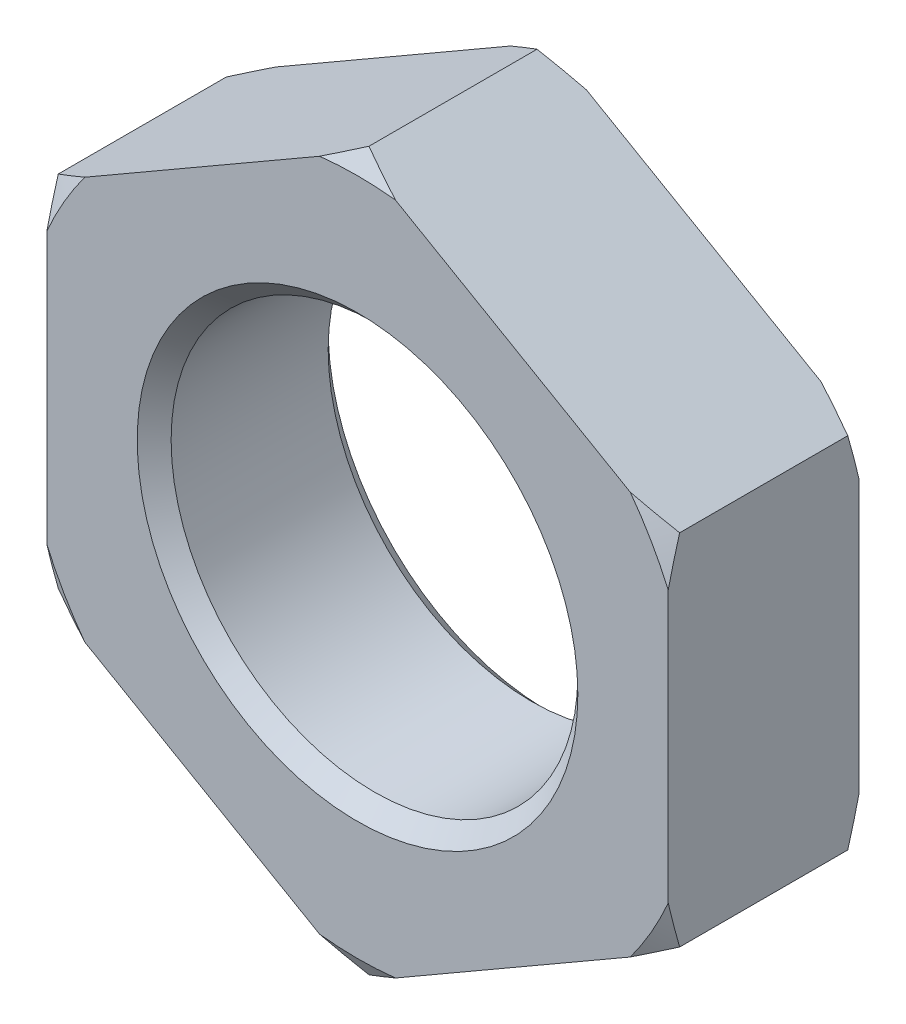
SolidWorks part; units mm, degrees
ref_plane "Front Plane" through (0, 0, 0) normal (0, 0, 1) x (1, 0, 0)
ref_plane "Top Plane" through (0, 0, 0) normal (0, 1, 0) x (1, 0, 0)
ref_plane "Right Plane" through (0, 0, 0) normal (1, 0, 0) x (0, 0, -1)
sketch "Sketch1" plane through (0, 0, 0) normal (0, 0, 1) x (1, 0, 0)
  line L1 (0, 31.7543) -> (-27.5, 15.8771)
  line L2 (-27.5, 15.8771) -> (-27.5, -15.8771)
  line L3 (-27.5, -15.8771) -> (0, -31.7543)
  line L4 (0, -31.7543) -> (27.5, -15.8771)
  line L5 (27.5, -15.8771) -> (27.5, 15.8771)
  line L6 (27.5, 15.8771) -> (0, 31.7543)
  circle A0 centre (0, 0) radius 27.5 construction
  circle A1 centre (0, 0) radius 18
  dimension "D2" = 36
  dimension "D1" = 55
extrude "Boss-Extrude1" add sketch "Sketch1" along normal mid plane 16.9
sketch "Sketch2" plane through (0, 0, 0) normal (1, 0, 0) x (0, 0, -1)
  line L0 (7.477, 0) -> (-8.5759, 0) construction
sketch "Sketch3" plane through (0, 0, 0) normal (1, 0, 0) x (0, 0, -1)
  line L0 (-8.45, 31.7543) -> (-8.45, 30.0043)
  line L1 (-8.45, 15.8771) -> (-8.45, 31.7543) construction
  line L2 (-8.45, 30.0043) -> (-7.4396, 31.7543)
  line L3 (-8.45, 31.7543) -> (8.45, 31.7543) construction
  line L4 (-7.4396, 31.7543) -> (-8.45, 31.7543)
  dimension "D1" = 1.75
  dimension "D2" = 30
revolve "Cut-Revolve1" cut sketch "Sketch3" angle 360 about L0
mirror "Mirror1" about plane through (0, 0, 0) normal (0, 0, 1) of "Cut-Revolve1"
chamfer "Chamfer1" distance 1.5 angle 45 2 edges at (18, 0, -8.45) (18, 0, 8.45)
